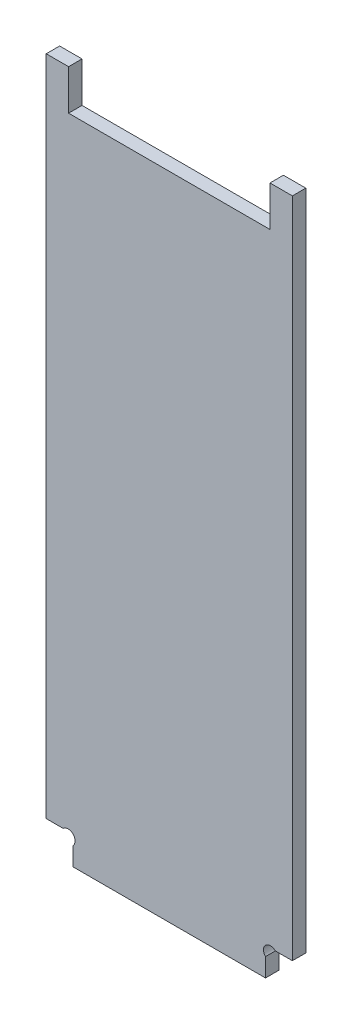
SolidWorks part; units mm, degrees
ref_plane "Plan de face" through (0, 0, 0) normal (0, 0, 1) x (1, 0, 0)
ref_plane "Plan de dessus" through (0, 0, 0) normal (0, 1, 0) x (1, 0, 0)
ref_plane "Plan de droite" through (0, 0, 0) normal (1, 0, 0) x (0, 0, -1)
sketch "Esquisse1" plane through (0, 0, 0) normal (0, 0, 1) x (1, 0, 0)
  line L0 (0, -11.0537) -> (0, 165.0235) construction
  line L1 (-17.544, 0) -> (106.1388, 0) construction
  line L2 (5, 150.2094) -> (5, 126.7022) construction
  line L3 (55, -11.0537) -> (55, 165.0235) construction
  line L4 (5, 139) -> (9.2933, 143.2933) construction
  line L5 (94.3916, 148) -> (-12.4131, 148) construction
  line L6 (3.7732, 139) -> (49.5795, 139) construction
  line L7 (50, 148) -> (55, 148)
  line L8 (50, 128.7022) -> (50, 162.5241) construction
  line L9 (0, 148) -> (5, 148)
  line L10 (27.5, 146.4746) -> (27.5, 123.8461) construction
  line L11 (0, 148) -> (0, 0)
  line L12 (6, 0) -> (-9.004, -15.004) construction
  line L13 (55, 148) -> (55, 0)
  line L14 (-5, -6.3386) -> (64.8734, -6.3386) construction
  line L15 (5, 148) -> (5, 139)
  line L16 (5, 139) -> (50, 139)
  line L17 (50, 148) -> (50, 139)
  line L18 (6, -9.0412) -> (6, 3.0741) construction
  line L19 (0, 0) -> (3.808, 0)
  line L20 (49, 3.0741) -> (49, -11.0537) construction
  line L21 (6, -2.192) -> (6, -6.3386)
  line L22 (6, -6.3386) -> (49, -6.3386)
  line L23 (49, -6.3386) -> (49, -2.192)
  line L24 (51.192, 0) -> (55, 0)
  arc A2 (6, -2.192) -> (3.808, 0) centre (4.904, -1.096) ccw
  arc A3 (49, -2.192) -> (51.192, 0) centre (50.096, -1.096) cw
  dimension "D3" = 6
  dimension "D6" = 5
  dimension "D1" = 9
  dimension "D4" = 6
  dimension "D5" = 45
extrude "Extrusion1" add sketch "Esquisse1" along normal blind 3
